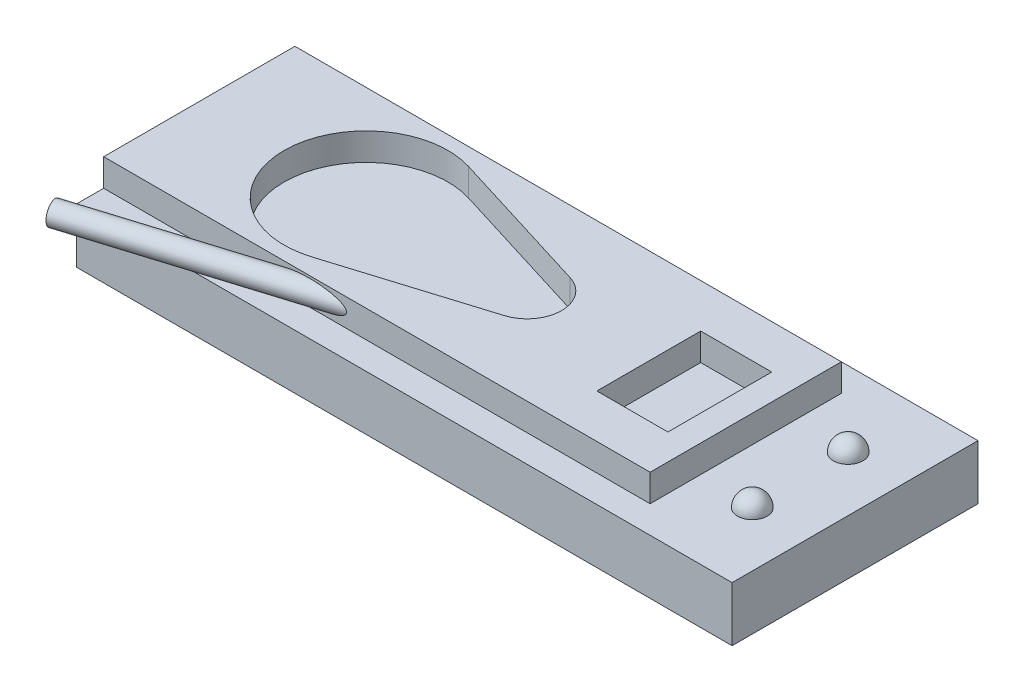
SolidWorks part; units mm, degrees
ref_plane "Front Plane" through (0, 0, 0) normal (0, 0, 1) x (1, 0, 0)
ref_plane "Top Plane" through (0, 0, 0) normal (0, 1, 0) x (1, 0, 0)
ref_plane "Right Plane" through (0, 0, 0) normal (1, 0, 0) x (0, 0, -1)
sketch "Sketch1" plane through (0, 0, 0) normal (0, 1, 0) x (1, 0, 0)
  line L1 (-60, 22.5) -> (60, 22.5)
  line L2 (-60, 22.5) -> (-60, -22.5)
  line L3 (-60, -22.5) -> (60, -22.5)
  line L4 (60, 22.5) -> (60, -22.5)
  line L5 (-60, 22.5) -> (60, -22.5) construction
  line L6 (-60, -22.5) -> (60, 22.5) construction
  point P0 (0, 0)
  dimension "D1" = 45
  dimension "D2" = 120
extrude "Boss-Extrude1" add sketch "Sketch1" along normal blind 10
sketch "Sketch2" plane through (0, 10, 0) normal (0, 1, 0) x (1, 0, 0)
  line L1 (-60, -17.5) -> (40, -17.5)
  line L2 (-60, -17.5) -> (-60, 17.5)
  line L3 (-60, 17.5) -> (40, 17.5)
  line L4 (40, -17.5) -> (40, 17.5)
  line L5 (-60, -17.5) -> (40, 17.5) construction
  line L6 (-60, 17.5) -> (40, -17.5) construction
  line L7 (-60, 22.5) -> (-60, -22.5) construction
  point P0 (0, 0)
  point P5 (0, 0)
  point P8 (-10, 0)
  dimension "D1" = 35
  dimension "D2" = 100
extrude "Boss-Extrude2" add sketch "Sketch2" along normal blind 5 contours L3 L4 L1 L2
sketch "Sketch3" plane through (0, 15, 0) normal (0, 1, 0) x (1, 0, 0)
  line L0 (1.8585, -6.0138) -> (-25.0547, -14.3312)
  line L1 (1.8585, 6.0138) -> (-25.0547, 14.3312)
  arc A0 (-25.0547, 14.3312) -> (-25.0547, -14.3312) centre (-29.4837, 0) ccw
  arc A1 (1.8585, -6.0138) -> (1.8585, 6.0138) centre (0, 0) ccw
extrude "Cut-Extrude1" cut sketch "Sketch3" against normal blind 5
sketch "Sketch4" plane through (0, 15, 0) normal (0, 1, 0) x (1, 0, 0)
  line L0 (-60, 17.5) -> (40, 17.5) construction
  line L1 (22.2556, -9.5) -> (35.2556, -9.5)
  line L2 (22.2556, -9.5) -> (22.2556, 9.5)
  line L3 (22.2556, 9.5) -> (35.2556, 9.5)
  line L4 (35.2556, -9.5) -> (35.2556, 9.5)
  line L5 (22.2556, -9.5) -> (35.2556, 9.5) construction
  line L6 (22.2556, 9.5) -> (35.2556, -9.5) construction
  line L7 (-60, -17.5) -> (40, -17.5) construction
  point P0 (28.7556, 0)
  dimension "D1" = 8
  dimension "D2" = 8
  dimension "D3" = 13
extrude "Cut-Extrude2" cut sketch "Sketch4" against normal blind 5
sketch "Sketch5" plane through (0, 10, 0) normal (0, 1, 0) x (1, 0, 0)
  line L0 (40, 17.5) -> (60, 0) construction
  line L1 (60, -22.5) -> (60, 22.5) construction
  line L2 (47.2687, 8.7727) -> (52.6794, 8.7727)
  arc A0 (52.6794, 8.7727) -> (47.2687, 8.7727) centre (49.974, 8.7727) ccw
  point P7 (49.974, 8.7727)
  point P10 (0, 0)
revolve "Revolve1" add sketch "Sketch5" angle 360 about L2
mirror "Mirror1" about plane through (0, 0, 0) normal (0, 0, 1) of "Revolve1"
ref_plane "Plane1" through (0, 0, 0) normal (-0.9554, 0, 0.2953) x (0, 1, 0)
sketch "Sketch6" plane through (0, 0, 0) normal (-0.9554, 0, 0.2953) x (0, 1, 0)
  circle A0 centre (12.5778, -10.1272) radius 2
  dimension "D1" = 4
extrude "Boss-Extrude3" add sketch "Sketch6" along normal blind 64
